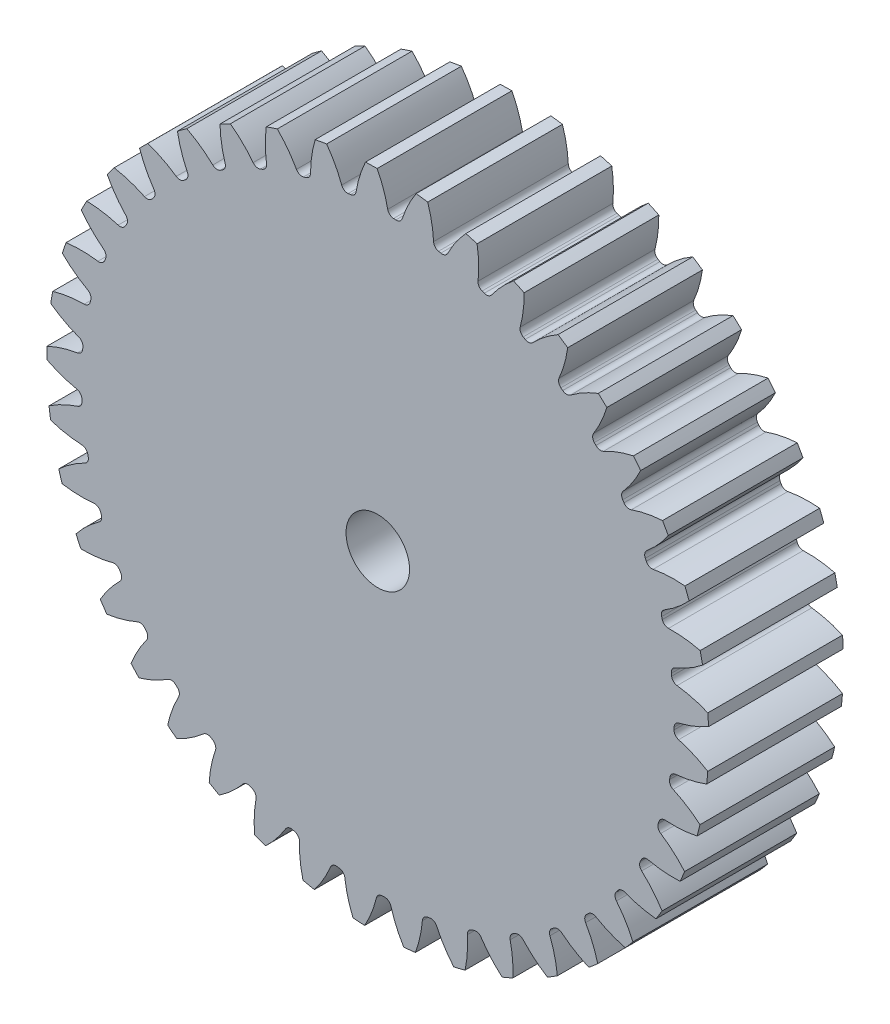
SolidWorks part; units mm, degrees
ref_plane "Front" through (0, 0, 0) normal (0, 0, 1) x (1, 0, 0)
ref_plane "Top" through (0, 0, 0) normal (0, 1, 0) x (1, 0, 0)
ref_plane "Right" through (0, 0, 0) normal (1, 0, 0) x (0, 0, -1)
sketch "Sketch3" plane through (0, 0, 0) normal (0, 0, 1) x (1, 0, 0)
  circle A0 centre (0, 0) radius 218.44
  dimension "od" = 436.88
extrude "gearBody" add sketch "Sketch3" along normal blind 88.9
sketch "Sketch2" plane through (0, 0, 0) normal (0, 0, 1) x (1, 0, 0)
  line L0 (0, 0) -> (180.8209, 74.8985) construction
  line L1 (217.9512, -17.0899) -> (0, 0) construction
  line L2 (0, 0) -> (36.3143, 0) construction
  line L3 (208.241, 4.0299) -> (207.9418, -11.8638) construction
  line L5 (208.0914, -3.9169) -> (0, 0) construction
  line L7 (0, 0) -> (195.7192, 0) construction
  arc A0 (195.7188, 0.385) -> (195.5657, -7.7502) centre (0, 0) ccw construction
  arc A1 (218.2637, 8.7755) -> (217.7788, -16.9831) centre (0, 0) ccw construction
  arc A2 (208.241, 4.0299) -> (207.9418, -11.8638) centre (0, 0) ccw construction
  arc A3 (195.5293, -4.4524) -> (195.5584, -2.9091) centre (0, 0) ccw
  arc A4 (217.9512, -17.0899) -> (198.5388, -8.5258) centre (177.8742, -81.6502) ccw
  arc A5 (217.9512, -17.0899) -> (218.44, 8.8756) centre (0, 0) ccw
  arc A6 (218.44, 8.8756) -> (198.719, 1.0482) centre (180.8209, 74.8985) cw
  arc A7 (195.5584, -2.9091) -> (198.719, 1.0482) centre (199.693, -2.9706) cw
  arc A8 (198.5388, -8.5258) -> (195.5293, -4.4524) centre (199.6634, -4.5465) cw
  point P6 (218.44, 8.8756)
  point P22 (217.9512, -17.0899)
  dimension "baseDia" = 391.4384
  dimension "od" = 436.88
  dimension "pd" = 416.56
  dimension "rd" = 391.16
  dimension "rFillet" = 4.1351
  dimension "pointX" = 218.44
  dimension "pointY" = 8.8756
  dimension "CTT" = 15.8937
  dimension "flankCenterAngle" = 22.5
extrude "toothCut" cut sketch "Sketch2" along normal through all
pattern_circular "CirPattern1" count 41 over 360 about axis through (0, 0, 0) along (0, 0, 1) of "toothCut"
sketch "hub1Dia" plane through (0, 0, 0) normal (0, 0, -1) x (-1, 0, 0)
  circle A0 centre (0, 0) radius 12.7
  dimension "hub1Dia" = 25.4
sketch "hub2Dia" plane through (0, 0, 88.9) normal (0, 0, 1) x (1, 0, 0)
  circle A0 centre (0, 0) radius 12.7
  dimension "hub2dia" = 25.4
sketch "boreDia" plane through (0, 0, 0) normal (0, 0, 1) x (1, 0, 0)
  circle A0 centre (0, 0) radius 20.955
  dimension "boreDia" = 41.91
extrude "bore" cut sketch "boreDia" against normal mid plane 25400
